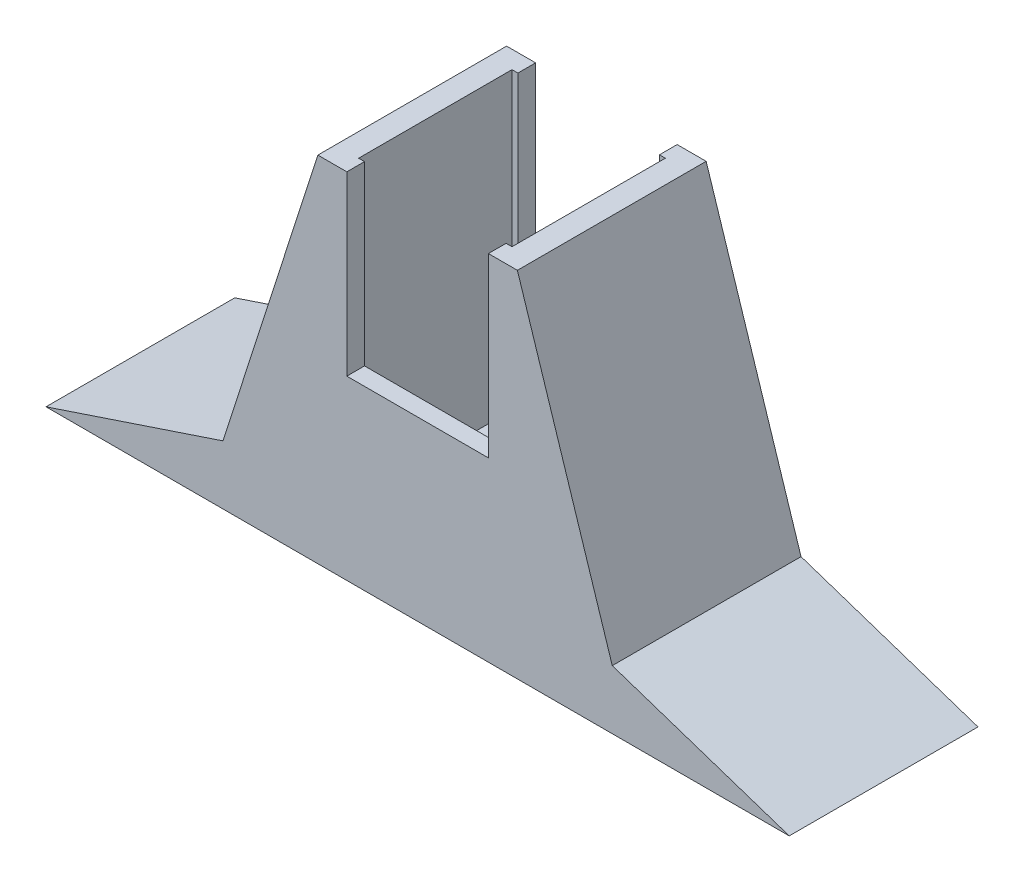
SolidWorks part; units mm, degrees
ref_plane "정면" through (0, 0, 0) normal (0, 0, 1) x (1, 0, 0)
ref_plane "윗면" through (0, 0, 0) normal (0, 1, 0) x (1, 0, 0)
ref_plane "우측면" through (0, 0, 0) normal (1, 0, 0) x (0, 0, -1)
sketch "스케치1" plane through (0, 0, 0) normal (0, 0, 1) x (1, 0, 0)
  line L0 (0, 0) -> (0, 30) construction
  line L1 (31.5, 0) -> (-31.5, 0)
  line L2 (-31.5, 0) -> (-16.5, 5)
  line L3 (31.5, 0) -> (16.5, 5)
  line L4 (-16.5, 5) -> (-11.5, 10)
  line L5 (16.5, 5) -> (11.5, 10)
  line L6 (-11.5, 10) -> (-8.4575, 30)
  line L7 (11.5, 10) -> (8.4575, 30)
  line L8 (-8.4575, 30) -> (8.4575, 30)
  dimension "D1" = 63
  dimension "D2" = 30
  dimension "D3" = 15
  dimension "D4" = 5
  dimension "D5" = 5
  dimension "D6" = 5
extrude "보스-돌출2" add sketch "스케치1" along normal blind 16 contours L8 L7 L5 L3 L1 L2 L4 L6
sketch "스케치3" plane through (0, 30, 0) normal (0, 1, 0) x (1, 0, 0)
  line L0 (0, 0) -> (0, -16) construction
  line L1 (-8.4575, -16) -> (8.4575, -16) construction
  line L2 (-8.4575, -8) -> (8.4575, -8) construction
  line L3 (-8.4575, -16) -> (-8.4575, 0) construction
  line L4 (8.4575, -16) -> (8.4575, 0) construction
  line L6 (-6.5, -14.5) -> (6.5, -14.5)
  line L7 (-6.5, -14.5) -> (-6.5, -1.5)
  line L8 (-6.5, -1.5) -> (6.5, -1.5)
  line L9 (6.5, -14.5) -> (6.5, -1.5)
  line L10 (0, -1.5) -> (0, -14.5) construction
  line L11 (-6.5, -8) -> (6.5, -8) construction
  point P11 (0, -8)
  dimension "D1" = 13
  dimension "D2" = 13
extrude "컷-돌출3" cut sketch "스케치3" against normal blind 25 contours L9 L8 L7 L6
sketch "스케치6" plane through (0, 0, 16) normal (0, 0, 1) x (1, 0, 0)
  line L0 (0, 0) -> (0, 30) construction
  line L1 (-8.4575, 30) -> (8.4575, 30) construction
  line L2 (0, 30) -> (0, 15) construction
  line L3 (0, 15) -> (-10.7394, 15) construction
  line L4 (-11.5, 10) -> (-8.4575, 30) construction
  line L5 (-10.7394, 15) -> (10.7394, 15) construction
  line L6 (11.5, 10) -> (8.4575, 30) construction
  line L8 (0, 15) -> (6, 15)
  line L9 (0, 15) -> (0, 30)
  line L10 (0, 30) -> (6, 30)
  line L11 (6, 15) -> (6, 30)
  line L12 (0, 15) -> (-6, 15)
  line L13 (0, 15) -> (0, 30)
  line L14 (0, 30) -> (-6, 30)
  line L15 (-6, 15) -> (-6, 30)
  dimension "D1" = 6
  dimension "D2" = 6
extrude "컷-돌출4" cut sketch "스케치6" against normal blind 25 contours L8 L11 L9 M10 | L15 L12 L9 M10
sketch "스케치7" plane through (0, 0, 16) normal (0, 0, 1) x (1, 0, 0)
  line L0 (-16.5, 5) -> (-8.4575, 30)
  line L1 (8.4575, 30) -> (11.5, 10)
  line L2 (-16.5, 5) -> (-11.5, 10)
  line L3 (-11.5, 10) -> (-8.4575, 30)
  line L4 (11.5, 10) -> (16.5, 5)
  line L5 (16.5, 5) -> (8.4575, 30)
extrude "보스-돌출3" add sketch "스케치7" against normal blind 16
